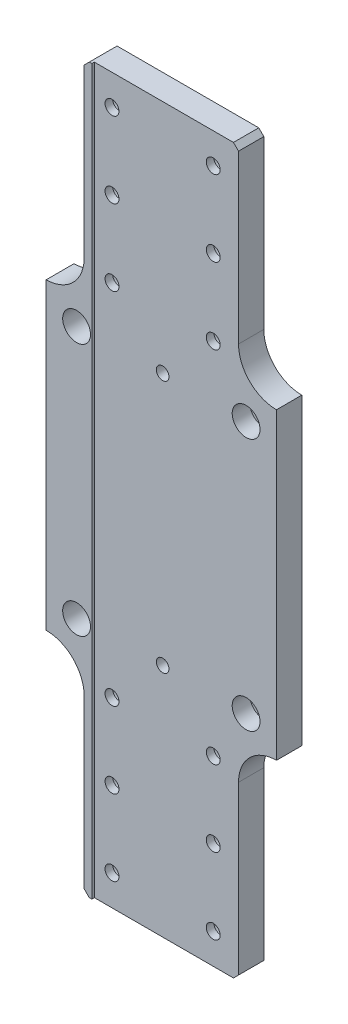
SolidWorks part; units mm, degrees
ref_plane "정면" through (0, 0, 0) normal (0, 0, 1) x (1, 0, 0)
ref_plane "윗면" through (0, 0, 0) normal (0, 1, 0) x (1, 0, 0)
ref_plane "우측면" through (0, 0, 0) normal (1, 0, 0) x (0, 0, -1)
sketch "스케치1" plane through (0, 0, 0) normal (0, 0, 1) x (1, 0, 0)
  line L1 (-45, 60) -> (45, 60)
  line L2 (-45, 60) -> (-45, -60)
  line L3 (-45, -60) -> (45, -60)
  line L4 (45, 60) -> (45, -60)
  line L5 (-30, -143) -> (30, -143)
  line L6 (-30, -143) -> (-30, 143)
  line L7 (-30, 143) -> (30, 143)
  line L8 (30, -143) -> (30, 143)
  line L9 (-30, -143) -> (30, 143) construction
  line L10 (-30, 143) -> (30, -143) construction
  point P4 (0, 0)
  dimension "D1" = 60
  dimension "D2" = 15
  dimension "D3" = 15
  dimension "D4" = 120
  dimension "D5" = 83
  dimension "D6" = 83
extrude "보스-돌출1" add sketch "스케치1" along normal mid plane 11 contours L1 L8 L7 L6 | L5 L8 L3 L6
sketch "스케치2" plane through (0, 0, 5.5) normal (0, 0, 1) x (1, 0, 0)
  line L0 (-30, 143) -> (30, 143) construction
  line L1 (-27, 143) -> (45, 143)
  line L2 (-27, 143) -> (-27, -143)
  line L3 (-27, -143) -> (45, -143)
  line L4 (45, 143) -> (45, -143)
  line L5 (45, 60) -> (45, -60) construction
  line L6 (-30, -143) -> (30, -143) construction
  line L7 (-45, 60) -> (-45, -60) construction
  dimension "D1" = 18
extrude "컷-돌출1" cut sketch "스케치2" against normal blind 1
hole_wizard "M6 소켓 머리 캡 나사용 카운터보어1" positions "스케치5" profile "스케치6" counterbore size "M6" standard "KS"
sketch "스케치5" plane through (0, 0, 5.5) normal (0, 0, 1) x (1, 0, 0)
  line L2 (-45, 60) -> (-45, -60) construction
  line L3 (-30, 143) -> (-27, 143) construction
  point P0 (-33, 50)
  point P2 (33, 50)
  point P4 (-33, -50)
  point P6 (33, -50)
  dimension "D1" = 66
  dimension "D2" = 12
  dimension "D3" = 100
  dimension "D4" = 93
sketch "스케치6" plane through (-33, 50, 5.5) normal (1, 0, 0) x (0, -1, 0)
  line L0 (0, 0) -> (0, 11)
  line L1 (0, 11) -> (3.3, 11)
  line L3 (3.3, 11) -> (3.3, 8)
  line L4 (3.3, 8) -> (5.5, 8)
  line L5 (5.5, 8) -> (5.5, 0)
  line L7 (5.5, 0) -> (0, 0)
  line L11 (0, -6.35) -> (0, 107.95) construction
  dimension "관통 구멍 지름" = 6.6
  dimension "관통 구멍 깊이" = 11
  dimension "카운터보어 지름" = 11
  dimension "카운터보어 깊이" = 8
hole_wizard "Ø5.0mm 맞춤핀 구멍1" positions "스케치7" profile "스케치8" hole size "Ø5.0" standard "ISO"
sketch "스케치7" plane through (0, 0, 4.5) normal (0, 0, 1) x (1, 0, 0)
  line L0 (0, 0) -> (0, 183.771) construction
  line L1 (30, 143) -> (-27, 143) construction
  point P6 (0, 50)
  point P8 (0, -50)
  dimension "D1" = 100
  dimension "D2" = 93
sketch "스케치8" plane through (0, -50, 4.5) normal (1, 0, 0) x (0, -1, 0)
  line L0 (0, 0) -> (0, 10)
  line L1 (0, 10) -> (2.5, 10)
  line L2 (2.5, 10) -> (2.5, 0)
  line L5 (2.5, 0) -> (0, 0)
  line L11 (0, -6.35) -> (0, 107.95) construction
  dimension "관통 구멍 지름" = 5
  dimension "관통 구멍 깊이" = 10
hole_wizard "M5 소켓 머리 캡 나사용 카운터보어1" positions "스케치9" profile "스케치10" counterbore size "M5" standard "KS"
sketch "스케치9" plane through (0, 0, -5.5) normal (0, 0, -1) x (-1, 0, 0)
  line L0 (0, 0) -> (0, 154.3469) construction
  line L2 (30, 143) -> (-30, 143) construction
  point P0 (-20, 131)
  point P2 (20, 131)
  point P4 (-20, 101)
  point P6 (20, 101)
  point P8 (-20, 71)
  point P10 (20, 71)
  dimension "D1" = 40
  dimension "D2" = 20
  dimension "D3" = 12
  dimension "D4" = 30
  dimension "D5" = 30
sketch "스케치10" plane through (20, 131, -5.5) normal (1, 0, 0) x (0, 1, 0)
  line L0 (0, 0) -> (0, 11)
  line L1 (0, 11) -> (2.75, 11)
  line L3 (2.75, 11) -> (2.75, 7)
  line L4 (2.75, 7) -> (4.75, 7)
  line L5 (4.75, 7) -> (4.75, 0)
  line L7 (4.75, 0) -> (0, 0)
  line L11 (0, -6.35) -> (0, 107.95) construction
  dimension "관통 구멍 지름" = 5.5
  dimension "관통 구멍 깊이" = 11
  dimension "카운터보어 지름" = 9.5
  dimension "카운터보어 깊이" = 7
pattern_linear "선형 패턴1" count 2 spacing 202 along (0, -1, 0) of "M5 소켓 머리 캡 나사용 카운터보어1"
fillet "필렛1" radius 15 4 edges at (-30, -60, 0) (30, -60, -0.5) (30, 60, -0.5) (-30, 60, 0)
chamfer "모따기1" distance 2 angle 45 4 edges at (30, -143, -0.5) (-30, -143, 0) (30, 143, -0.5) (-30, 143, 0)
